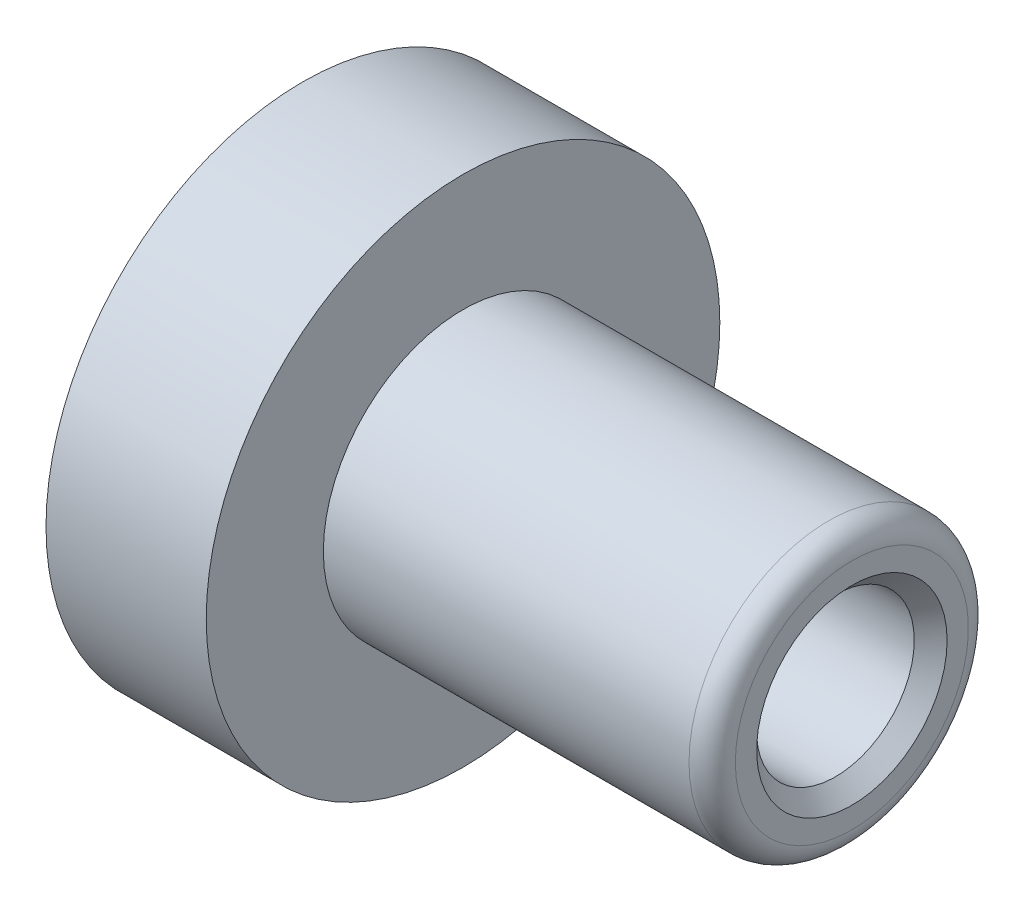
SolidWorks part; units mm, degrees
ref_plane "Front Plane" through (0, 0, 0) normal (0, 0, 1) x (1, 0, 0)
ref_plane "Top Plane" through (0, 0, 0) normal (0, 1, 0) x (1, 0, 0)
ref_plane "Right Plane" through (0, 0, 0) normal (1, 0, 0) x (0, 0, -1)
sketch "Sketch1" plane through (0, 0, 0) normal (0, 0, 1) x (1, 0, 0)
  line L0 (0, 0) -> (102.3864, 0) construction
  line L1 (0, 6.7437) -> (0, 17.4625)
  line L2 (0, 17.4625) -> (10.8966, 17.4625)
  line L3 (10.8966, 17.4625) -> (10.8966, 9.4996)
  line L4 (10.8966, 9.4996) -> (35.7632, 9.4996)
  line L5 (37.338, 7.9248) -> (37.338, 0)
  line L6 (37.338, 0) -> (20.447, 0)
  line L7 (0, 6.7437) -> (20.447, 6.7437)
  line L8 (20.447, 6.7437) -> (20.447, 0)
  arc A0 (37.338, 7.9248) -> (35.7632, 9.4996) centre (35.7632, 7.9248) ccw
  dimension "D5" = 1.5748
  dimension "D1" = 10.8966
  dimension "D2" = 34.925
  dimension "D3" = 20.447
  dimension "D4" = 13.4874
  dimension "D6" = 37.338
  dimension "D7" = 18.9992
revolve "Revolve1" add sketch "Sketch1" angle 360 about L0
sketch "Sketch2" plane through (0, 0, 0) normal (-1, 0, 0) x (0, 0, 1)
  line L0 (0, 0) -> (0, 9.7644) construction
  circle A0 centre (-11.1125, 0) radius 1.6129
  circle A1 centre (11.1125, 0) radius 1.6129
  dimension "D2" = 3.2258
  dimension "D1" = 22.225
extrude "Cut-Extrude1" cut sketch "Sketch2" against normal blind 6.35
sketch "Sketch3" plane through (37.338, 0, 0) normal (1, 0, 0) x (0, 0, -1)
  circle A0 centre (0, 0) radius 5.3594
  dimension "D1" = 10.7188
extrude "Cut-Extrude2" cut sketch "Sketch3" against normal through all
chamfer "Chamfer1" distance 1.1176 angle 45 1 edges at (37.338, 0, -5.3594)
